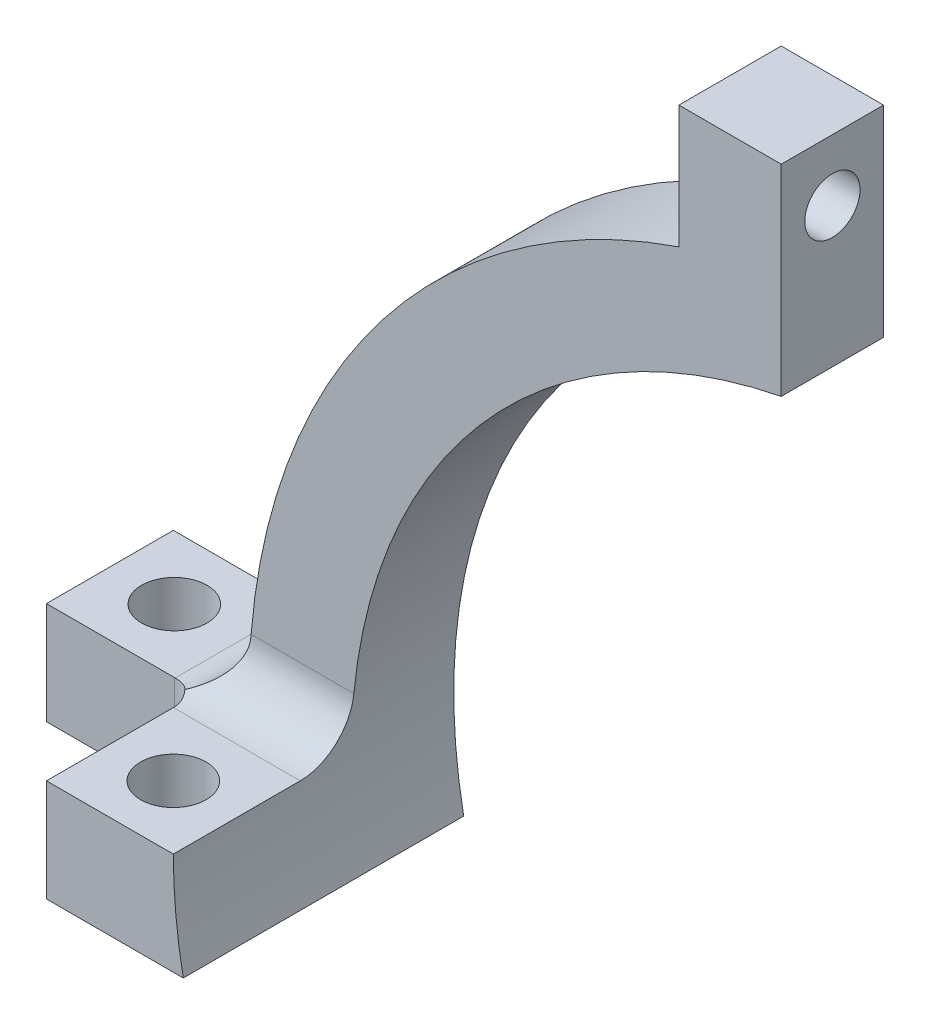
SolidWorks part; units mm, degrees
other "<Trava_suporte_dremel>-<Filete2>"
ref_plane "Plano frontal" through (0, 0, 0) normal (0, 0, 1) x (1, 0, 0)
ref_plane "Plano superior" through (0, 0, 0) normal (0, 1, 0) x (1, 0, 0)
ref_plane "Plano direito" through (0, 0, 0) normal (1, 0, 0) x (0, 0, -1)
ref_plane "Plano frontal-Trava_suporte_dremel_Espelhada" through (0, 0, 0) normal (0, 0, -1) x (1, 0, 0)
ref_plane "Plano superior-Trava_suporte_dremel_Espelhada" through (0, 0, 0) normal (0, 1, 0) x (1, 0, 0)
ref_plane "Plano direito-Trava_suporte_dremel_Espelhada" through (0, 0, 0) normal (1, 0, 0) x (0, 0, 1)
sketch "Esboço1-Trava_suporte_dremel_Espelhada" plane through (0, 0, 0) normal (0, 0, 1) x (1, 0, 0)
  line L5 (5.4853, 0) -> (0, 0)
  line L6 (31, 33.3554) -> (31, 28.3554) construction
  line L7 (26, 40.3428) -> (26, 30.5147)
  line L9 (26, 40.3428) -> (21, 40.3428)
  line L10 (21, 40.3428) -> (21, 34.3428)
  line L11 (0, 5) -> (0, 0)
  arc A2 (0, 5) -> (21, 34.3428) centre (31, 5) cw
  arc A3 (26, 30.5147) -> (5.4853, 0) centre (31, 5) ccw
  point P1 (0, 0)
  point P3 (0, 0)
  point P4 (1.591, 4.0493)
  point P7 (1.8686, 9.3308)
  point P13 (0, 5.2904)
  point P15 (0, 7.0885)
  point P17 (5, 5)
  point P18 (5, 5)
  point P19 (2.7538, 0.8267)
  point P20 (5, 5)
  point P22 (5.8235, 0)
  point P23 (5.5857, 0)
  dimension "D1" = 5
  dimension "D2" = 5
  dimension "D4" = 26
  dimension "D6" = 5
  dimension "D7" = 6
  dimension "D8" = 5
sketch "Esboço5-Trava_suporte_dremel_Espelhada" plane through (0, 0, 0) normal (1, 0, 0) x (0, 0, -1)
  line L1 (-1.2, 0) -> (5, 0)
  line L2 (-1.2, 0) -> (-1.2, 5)
  line L3 (-1.2, 5) -> (5, 5)
  line L4 (5, 0) -> (5, 5)
  point P7 (0, 0)
  dimension "D1" = 6.2
sketch "Esboço4-Trava_suporte_dremel_Espelhada" plane through (0, 0, 0) normal (0, 0, 1) x (1, 0, 0)
  line L2 (-1.2, 0) -> (5.4853, 0)
  line L4 (5, 5) -> (-1.2, 5)
  line L5 (-1.2, 5) -> (-1.2, 0)
  arc A1 (5, 5) -> (5.4853, 0) centre (31, 5) ccw
  point P8 (0, 0)
  point P11 (0, 0)
  point P12 (0, 0)
  point P13 (0, 0)
  point P14 (5.4853, 0)
  dimension "D1" = 6.2
  dimension "D2" = 5
sketch "Esboço2-Trava_suporte_dremel_Espelhada" plane through (21, 0, 0) normal (1, 0, 0) x (0, 0, -1)
  line L0 (0, 40.3428) -> (5, 34.3428) construction
  circle A0 centre (2.5, 37.3428) radius 1.35
  dimension "D1" = 2.7
sketch "Esboço3-Trava_suporte_dremel_Espelhada" plane through (0, 5, 0) normal (0, -1, 0) x (1, 0, 0)
  line L0 (-2.4066, -5) -> (-8.7, 1.2) construction
  line L1 (-1.2, 2.5) -> (5, 8.7) construction
  circle A0 centre (-5.5533, -1.9) radius 1.6
  circle A1 centre (1.9, 5.6) radius 1.6
  point P12 (1.9, 5.6)
  point P13 (0, 0)
  point P14 (-2.4066, -6.2)
  point P16 (0, 0)
  point P17 (-6.2, 0)
  point P20 (-4.3033, -3.5793)
  point P21 (-6.2, 0)
  point P23 (0, 0)
  point P24 (0, 0)
  point P25 (-1.2, 3.1524)
  point P28 (-5.276, -5)
  point P31 (-1.2, 2.5)
  point P33 (-2.4066, -5)
  point P38 (0, 0)
  point P39 (-8.7, 1.2)
  point P42 (0, 0)
  dimension "D1" = 3.2
mirrored part "Trava_suporte_dremel_Espelhada" parameters "D1.Ressalto-extrusão1"=5, "D4.Esboço1"=26, "D6.Esboço1"=5, "D7.Esboço1"=6, "D8.Esboço1"=5, "D2.Esboço1"=5, "D1.Esboço1"=5, "D1.Ressalto-extrusão3"=8.7, "D1.Esboço5"=6.2, "D1.Ressalto-extrusão2"=8.7, "D1.Esboço4"=6.2, "D2.Esboço4"=5, "D1.Filete1"=2.5, "D1.Esboço2"=2.7, "D1.Esboço3"=3.2, "D1.Filete2"=1.25
